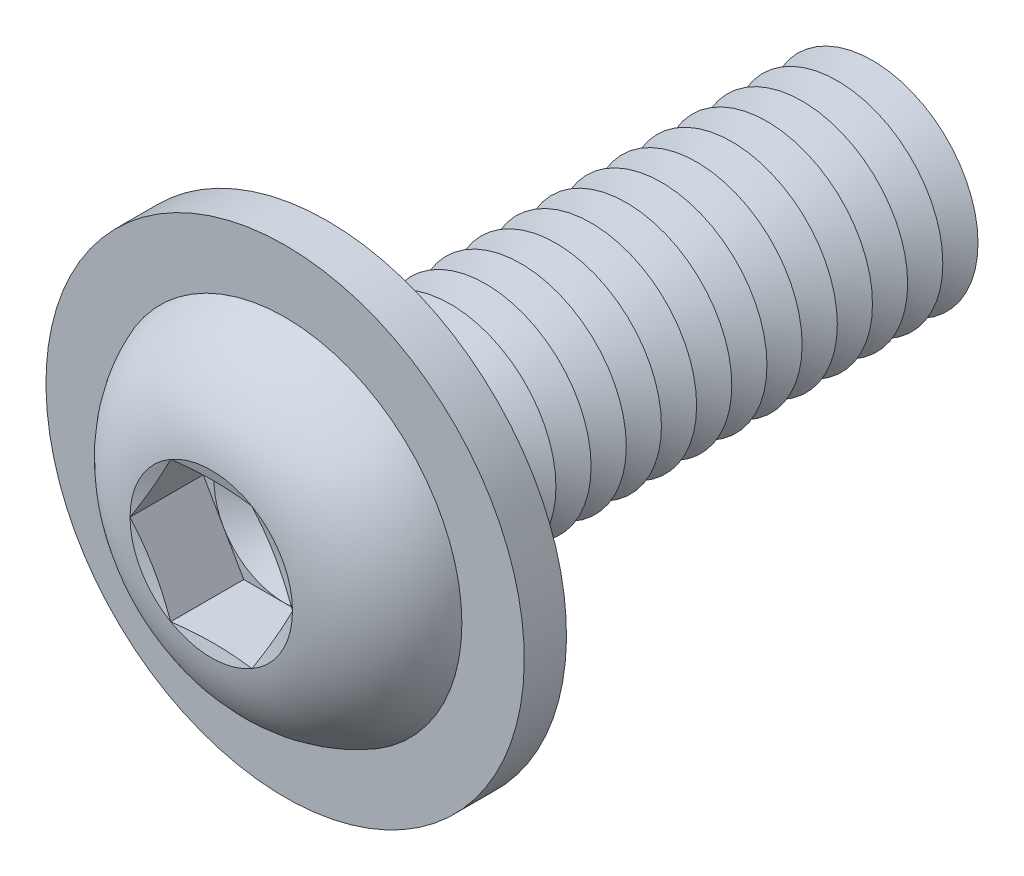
SolidWorks part; units mm, degrees
ref_plane "Front Plane" through (0, 0, 0) normal (0, 0, 1) x (1, 0, 0)
ref_plane "Top Plane" through (0, 0, 0) normal (0, 1, 0) x (1, 0, 0)
ref_plane "Right Plane" through (0, 0, 0) normal (1, 0, 0) x (0, 0, -1)
sketch "Sketch1" plane through (0, 0, 0) normal (1, 0, 0) x (0, 0, -1)
  line L0 (0, 3) -> (0, 5.25)
  line L3 (0, 3) -> (16, 3)
  line L4 (16, 3) -> (16, 0)
  line L5 (16, 0) -> (-3.3, 0) construction
  line L6 (-3.3, 0) -> (16, 0)
  line L7 (-3.3, 2.3094) -> (-3.3, 1.1547) construction
  line L8 (-3.3, 1.1547) -> (-3.3, 0)
  line L9 (-3.3, 2.3094) -> (-2.9906, 1.1547)
  line L10 (-2.9906, 1.1547) -> (-3.3, 1.1547)
  line L11 (16, 0) -> (22.7481, 0) construction
  line L12 (0, 5.25) -> (-3.3, 5.25) construction
  arc A1 (0, 5.25) -> (-3.3, 2.3094) centre (0, 1.928) ccw
  point P8 (16, 1.5)
  dimension "D1" = 10.5
  dimension "D2" = 6
  dimension "D3" = 3.3
  dimension "D4" = 4.6188
  dimension "D5" = 16
  dimension "D6" = 15
revolve "Revolve1" add sketch "Sketch1" angle 360 about L5
fillet "Fillet1" radius 0.5 1 edges at (-3, 0, 0)
sketch "Sketch2" plane through (0, 0, 0) normal (1, 0, 0) x (0, 0, -1)
  line L0 (15.5, 3) -> (16.5, 3)
  line L1 (16, 3) -> (0.5, 3) construction
  line L2 (16.5, 3) -> (16, 2.134)
  line L3 (16, -3) -> (16, 3) construction
  line L4 (16, 2.134) -> (15.5, 3)
  dimension "D1" = 1
revolve "Cut-Revolve1" cut sketch "Sketch2" angle 360 about axis through (0, 0, -16) along (0, 0, -1)
pattern_linear "LPattern1" count 16 spacing 1 along (0, 0, 1) of "Cut-Revolve1"
sketch "Sketch3" plane through (0, 0, 3.3) normal (0, 0, 1) x (1, 0, 0)
  line L7 (1.1547, 2) -> (-1.1547, 2)
  line L8 (-1.1547, 2) -> (-2.3094, 0)
  line L9 (-2.3094, 0) -> (-1.1547, -2)
  line L10 (-1.1547, -2) -> (1.1547, -2)
  line L11 (1.1547, -2) -> (2.3094, 0)
  line L12 (2.3094, 0) -> (1.1547, 2)
  circle A0 centre (0, 0) radius 2 construction
  circle A3 centre (0, 0) radius 2.3094 construction
extrude "Cut-Extrude1" cut sketch "Sketch3" against normal blind 2.08
sketch "Sketch4" plane through (0, 0, 1.22) normal (0, 0, 1) x (1, 0, 0)
  line L1 (1.1547, 2) -> (-1.1547, 2) construction
  circle A0 centre (0, 0) radius 2
extrude "Cut-Extrude2" cut sketch "Sketch4" against normal through all draft 60
sketch "Sketch5" plane through (0, 0, 0) normal (0, 0, -1) x (-1, 0, 0)
  circle A0 centre (0, 0) radius 6.8
  circle A1 centre (0, 0) radius 3.5
  circle A2 centre (0, 0) radius 3.5 construction
  dimension "D1" = 13.6
extrude "Boss-Extrude1" add sketch "Sketch5" against normal blind 1.2
